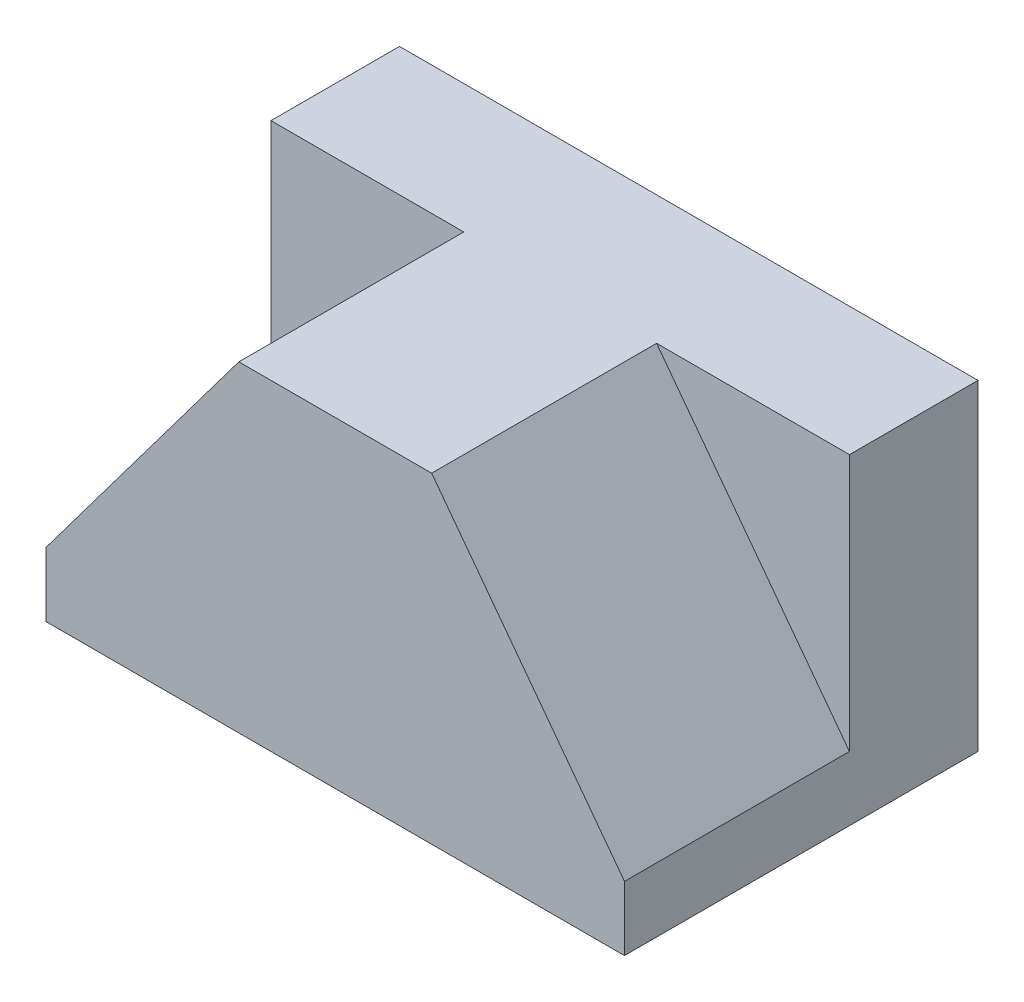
SolidWorks part; units mm, degrees
ref_plane "前视基准面" through (0, 0, 0) normal (0, 0, 1) x (1, 0, 0)
ref_plane "上视基准面" through (0, 0, 0) normal (0, 1, 0) x (1, 0, 0)
ref_plane "右视基准面" through (0, 0, 0) normal (1, 0, 0) x (0, 0, -1)
sketch "草图1" plane through (0, 0, 0) normal (0, 1, 0) x (1, 0, 0)
  line L1 (0, 0) -> (90, 0)
  line L2 (0, 0) -> (0, 55)
  line L3 (0, 55) -> (90, 55)
  line L4 (90, 0) -> (90, 55)
  dimension "D1" = 90
  dimension "D2" = 55
extrude "拉伸1" add sketch "草图1" along normal blind 50
sketch "草图2" plane through (0, 0, 0) normal (0, 0, 1) x (1, 0, 0)
  line L0 (0, 50) -> (30, 50)
  line L1 (0, 50) -> (90, 50) construction
  line L2 (30, 50) -> (0, 10)
  line L3 (0, 50) -> (0, 0) construction
  line L4 (0, 10) -> (0, 50)
  line L5 (45, 50) -> (45, 58.6207) construction
  line L6 (90, 10) -> (90, 50)
  line L7 (60, 50) -> (90, 10)
  line L8 (90, 50) -> (60, 50)
  dimension "D1" = 30
  dimension "D2" = 40
extrude "切除-拉伸1" cut sketch "草图2" against normal blind 35
